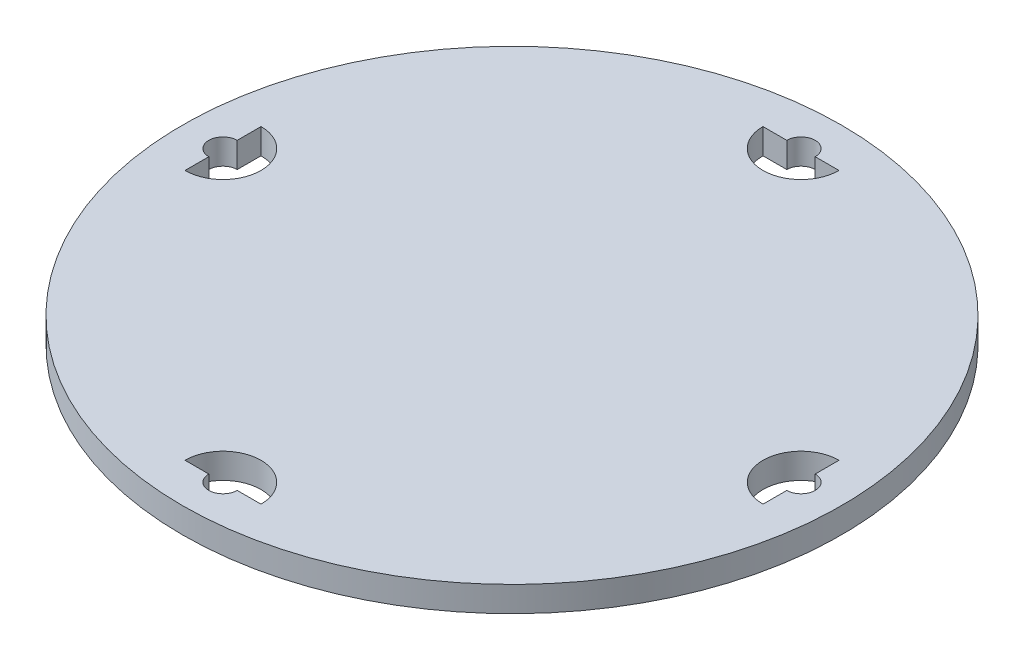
SolidWorks part; units mm, degrees
ref_plane "Front Plane" through (0, 0, 0) normal (0, 0, 1) x (1, 0, 0)
ref_plane "Top Plane" through (0, 0, 0) normal (0, 1, 0) x (1, 0, 0)
ref_plane "Right Plane" through (0, 0, 0) normal (1, 0, 0) x (0, 0, -1)
sketch "Sketch2" plane through (0, 0, 0) normal (0, 1, 0) x (1, 0, 0)
  circle A0 centre (0, 0) radius 82.55
  dimension "D1" = 165.1
extrude "Boss-Extrude1" add sketch "Sketch2" along normal blind 6.35
sketch "Sketch3" plane through (0, 0, 0) normal (0, 1, 0) x (1, 0, 0)
  line L0 (-65.6144, -82.55) -> (39.8788, -82.55) construction
  line L1 (-3.556, -72.39) -> (-9.525, -72.39)
  line L2 (3.556, -72.39) -> (9.525, -72.39)
  circle A0 centre (0, -72.39) radius 3.556
  circle A1 centre (0, 0) radius 82.55 construction
  arc A2 (-9.525, -72.39) -> (9.525, -72.39) centre (0, -72.39) cw
  point P12 (8.031, -72.39)
  dimension "D1" = 7.112
  dimension "D2" = 10.16
  dimension "D3" = 9.525
extrude "Cut-Extrude2" cut sketch "Sketch3" along normal up to next contours A2 L1 A0 L2
pattern_circular "CirPattern1" count 4 over 360 about axis through (0, 0, 0) along (0, 1, 0) of "Cut-Extrude2"
